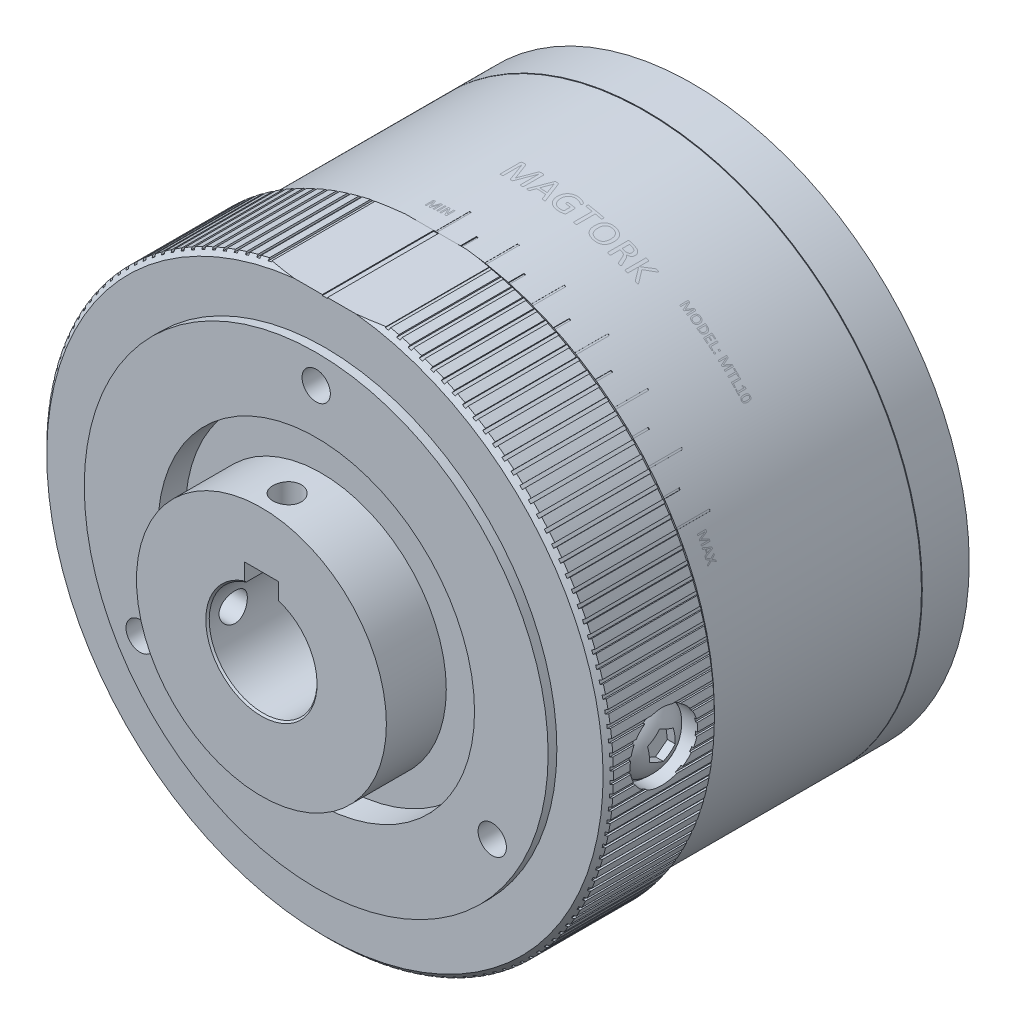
SolidWorks part; units mm, degrees
ref_plane "Front Plane" through (0, 0, 0) normal (0, 0, 1) x (1, 0, 0)
ref_plane "Top Plane" through (0, 0, 0) normal (0, 1, 0) x (1, 0, 0)
ref_plane "Right Plane" through (0, 0, 0) normal (1, 0, 0) x (0, 0, -1)
sketch "Sketch1" plane through (0, 0, 0) normal (1, 0, 0) x (0, 0, -1)
  line L0 (0, 0) -> (55.3488, 0) construction
  line L1 (0, 0) -> (0, 8.001) construction
  line L2 (0, 8.001) -> (0, 18.542)
  line L3 (0, 18.542) -> (8.89, 18.542)
  line L4 (8.128, 23.495) -> (8.128, 34.417)
  line L5 (8.128, 34.417) -> (9.4234, 34.417)
  line L6 (9.4234, 34.417) -> (9.4234, 42.037)
  line L7 (9.4234, 42.037) -> (25.9334, 42.037)
  line L8 (25.9334, 42.037) -> (25.9334, 41.021)
  line L9 (25.9334, 41.021) -> (56.9214, 41.021)
  line L10 (64.008, 41.021) -> (64.008, 8.001)
  line L11 (64.008, 8.001) -> (0, 8.001)
  line L12 (56.9214, 41.021) -> (56.9214, 40.894)
  line L13 (56.9214, 40.894) -> (57.0484, 40.894)
  line L14 (57.0484, 40.894) -> (57.0484, 41.021)
  line L15 (57.0484, 41.021) -> (64.008, 41.021)
  line L16 (8.89, 18.542) -> (8.89, 12.4968)
  line L17 (8.89, 12.4968) -> (12.192, 12.4968)
  line L18 (12.192, 12.4968) -> (12.192, 23.495)
  line L19 (12.192, 23.495) -> (8.128, 23.495)
  dimension "D1" = 16.002
  dimension "D2" = 37.084
  dimension "D3" = 84.074
  dimension "D4" = 82.042
  dimension "D5" = 64.008
  dimension "D6" = 55.88
  dimension "D7" = 54.5846
  dimension "D8" = 16.51
  dimension "D9" = 68.834
  dimension "D10" = 6.9596
  dimension "D11" = 0.127
  dimension "D12" = 0.127
  dimension "D13" = 24.9936
  dimension "D14" = 46.99
  dimension "D15" = 8.89
  dimension "D16" = 3.302
revolve "Revolve2" add sketch "Sketch1" angle 360 about L0
chamfer "Chamfer1" distance 0.762 angle 45 2 edges at (42.037, 0, -25.9334) (42.037, 0, -9.4234)
sketch "Sketch3" plane through (0, 0, -9.4234) normal (0, 0, 1) x (1, 0, 0)
  line L0 (0, 0) -> (0, -42.037) construction
  line L2 (-0.254, -42.291) -> (0.254, -42.291)
  line L3 (-0.254, -42.291) -> (-0.254, -41.783)
  line L4 (-0.254, -41.783) -> (0.254, -41.783)
  line L5 (0.254, -42.291) -> (0.254, -41.783)
  line L6 (-0.254, -42.291) -> (0.254, -41.783) construction
  line L7 (-0.254, -41.783) -> (0.254, -42.291) construction
  circle A0 centre (0, 0) radius 42.037 construction
  dimension "D1" = 0.508
  dimension "D2" = 0.508
extrude "Cut-Extrude2" cut sketch "Sketch3" against normal blind 72.136
pattern_circular "CirPattern1" count 150 over 360 about axis through (0, 0, 0) along (0, 0, 1) of "Cut-Extrude2"
sketch "Sketch2" plane through (0, 0, -9.4234) normal (0, 0, 1) x (1, 0, 0)
  line L0 (0, 0) -> (0, 41.021) construction
  line L1 (0, 41.021) -> (11.7059, 41.021)
  line L2 (0, 41.021) -> (-12.9169, 41.021)
  line L3 (-12.9169, 41.021) -> (-12.9169, 43.6558)
  line L4 (-12.9169, 43.6558) -> (11.7059, 43.6558)
  line L5 (11.7059, 43.6558) -> (11.7059, 41.021)
  dimension "D1" = 41.021
extrude "Cut-Extrude1" cut sketch "Sketch2" against normal up to next
sketch "Sketch4" plane through (0, 0, -9.4234) normal (0, 0, 1) x (1, 0, 0)
  line L0 (0, 41.021) -> (0, 40.894) construction
  line L1 (0, 40.894) -> (0.381, 40.894)
  line L2 (0, 40.894) -> (-0.381, 40.894)
  line L3 (-0.381, 40.894) -> (-0.381, 41.021)
  line L4 (-4.572, 41.021) -> (4.572, 41.021) construction
  line L5 (-0.381, 41.021) -> (0.381, 41.021)
  line L6 (0.381, 41.021) -> (0.381, 40.894)
  dimension "D1" = 0.127
  dimension "D2" = 0.762
extrude "Cut-Extrude3" cut sketch "Sketch4" against normal up to vertex
ref_plane "Plane1" through (42.037, 0, 0) normal (1, 0, 0) x (0, 0, -1)
sketch "Sketch5" plane through (42.037, 0, 0) normal (1, 0, 0) x (0, 0, -1)
  line L0 (9.4234, -0.127) -> (25.9334, -0.127) construction
  line L1 (9.4234, 41.021) -> (9.4234, -41.275) construction
  line L2 (25.9334, -41.275) -> (25.9334, 41.021) construction
  circle A0 centre (17.6784, -0.127) radius 5.0038
  dimension "D1" = 10.0076
extrude "Cut-Extrude4" cut sketch "Sketch5" against normal blind 2.54
sketch "Sketch6" plane through (0, 0, 0) normal (0, 1, 0) x (1, 0, 0)
  line L0 (39.4883, 17.6784) -> (42.0283, 17.6784) construction
  line L1 (39.4883, 10.1854) -> (39.4883, 25.1714) construction
  line L2 (39.4883, 17.6784) -> (39.4883, 22.3774) construction
  line L4 (39.4883, 17.6784) -> (42.0283, 17.6784)
  line L5 (39.4883, 17.6784) -> (39.4883, 22.3774)
  line L6 (39.4883, 22.3774) -> (39.4883, 17.6784)
  line L7 (39.4883, 22.3774) -> (39.9642, 22.3774)
  arc A0 (39.9642, 22.3774) -> (42.0283, 17.6784) centre (36.0555, 17.8576) cw
  dimension "D1" = 2.54
  dimension "D2" = 4.699
revolve "Revolve4" add sketch "Sketch6" angle 360 about L0
sketch "Sketch7" plane through (42.037, 0, 0) normal (1, 0, 0) x (0, 0, -1)
  line L1 (19.4446, 1.3461) -> (17.3957, 2.2027)
  line L2 (17.3957, 2.2027) -> (15.6295, 0.8565)
  line L3 (15.6295, 0.8565) -> (15.9122, -1.3461)
  line L4 (15.9122, -1.3461) -> (17.9611, -2.2027)
  line L5 (17.9611, -2.2027) -> (19.7273, -0.8565)
  line L6 (19.7273, -0.8565) -> (19.4446, 1.3461)
  circle A0 centre (17.6784, 0) radius 1.9232 construction
extrude "Cut-Extrude5" cut sketch "Sketch7" against normal blind 1.524
mirror "Mirror1" about plane through (0, 0, 0) normal (1, 0, 0) of "Cut-Extrude4", "Revolve4", "Cut-Extrude5"
sketch "Sketch8" plane through (0, 0, -64.008) normal (0, 0, -1) x (-1, 0, 0)
  circle A0 centre (0, 0) radius 23.495
  dimension "D1" = 46.99
extrude "Cut-Extrude6" cut sketch "Sketch8" against normal blind 4.064
ref_plane "Plane2" through (-18.542, 0, 0) normal (1, 0, 0) x (0, 0, -1)
hole_wizard "M5x0.8 Tapped Hole2" positions "Sketch17" profile "Sketch16" tap size "M5x0.8" standard "Ansi Metric"
sketch "Sketch17" plane through (0, 0, -8.128) normal (0, 0, 1) x (1, 0, 0)
  line L0 (0, 0) -> (-26.1215, -15.0813) construction
  line L2 (0, 0) -> (-21.1557, 0) construction
  point P0 (-26.1215, -15.0813)
  dimension "D1" = 30
  dimension "D2" = 30.1625
sketch "Sketch16" plane through (-26.1215, -15.0813, -8.128) normal (1, 0, 0) x (0, -1, 0)
  line L0 (0, 0) -> (0, 13.4538)
  line L1 (0, 13.4538) -> (2.1, 12.192)
  line L2 (2.1, 12.192) -> (2.1, 0)
  line L5 (2.1, 0) -> (0, 0)
  line L10 (0, 13.4538) -> (-2.1, 12.192) construction
  line L11 (0, -6.35) -> (0, 107.95) construction
  dimension "Tap Drill Dia." = 4.2
  dimension "Tap Drill Depth" = 12.192
  dimension "Drill Angle" = 118
pattern_circular "CirPattern3" count 3 over 360 about axis through (0, 0, 0) along (0, 0, 1) of "M5x0.8 Tapped Hole2"
ref_plane "Plane3" through (0, 0, -36.068) normal (0, 0, 1) x (1, 0, 0)
mirror "Mirror2" about plane through (0, 0, -36.068) normal (0, 0, 1) of "CirPattern3", "M5x0.8 Tapped Hole2"
sketch "Sketch18" plane through (0, 0, -64.008) normal (0, 0, -1) x (-1, 0, 0)
  line L0 (0, 0) -> (0, 38.354) construction
  circle A0 centre (0, 38.354) radius 2.1844
  dimension "D2" = 4.3688
  dimension "D1" = 38.354
extrude "Cut-Extrude10" cut sketch "Sketch18" against normal blind 2.54
sketch "Sketch19" plane through (0, 0, -61.468) normal (0, 0, -1) x (-1, 0, 0)
  circle A0 centre (0, 38.354) radius 1.778
  dimension "D1" = 3.556
extrude "Boss-Extrude2" add sketch "Sketch19" along normal blind 2.1844
sketch "Sketch20" plane through (0, 0, -63.6524) normal (0, 0, -1) x (-1, 0, 0)
  line L1 (1.1123, 38.8226) -> (0.1504, 39.5515)
  line L2 (0.1504, 39.5515) -> (-0.9619, 39.083)
  line L3 (-0.9619, 39.083) -> (-1.1123, 37.8854)
  line L4 (-1.1123, 37.8854) -> (-0.1504, 37.1565)
  line L5 (-0.1504, 37.1565) -> (0.9619, 37.625)
  line L6 (0.9619, 37.625) -> (1.1123, 38.8226)
  circle A0 centre (0, 38.354) radius 1.0452 construction
extrude "Cut-Extrude11" cut sketch "Sketch20" against normal blind 1.524
pattern_circular "CirPattern4" count 4 over 360 about axis through (0, 0, 0) along (0, 0, 1) of "Cut-Extrude11", "Boss-Extrude2", "Cut-Extrude10"
chamfer "Chamfer3" distance 0.254 angle 45 2 edges at (-8.001, 0, -59.944) (8.001, 0, 0)
ref_plane "Plane4" through (0, 41.021, 0) normal (0, 1, 0) x (-1, 0, 0)
ref_plane "Plane5" through (0, 0, -25.9334) normal (0, 0, 1) x (1, 0, 0)
sketch "Sketch21" plane through (0, 0, -25.9334) normal (0, 0, 1) x (1, 0, 0)
  line L0 (0, 0) -> (0, 41.021) construction
  line L1 (0.127, 40.9956) -> (0.127, 41.021)
  line L2 (-0.127, 40.9956) -> (-0.127, 41.021)
  line L3 (-0.127, 41.021) -> (0.127, 41.021)
  line L4 (-0.127, 40.9956) -> (0.127, 40.9956)
  line L5 (-0.127, 0) -> (-0.127, 41.021) construction
  line L6 (0.127, 0) -> (0.127, 41.021) construction
  arc A0 (0.381, 41.0192) -> (-0.381, 41.0192) centre (0, 0) ccw construction
  dimension "D3" = 0.0254
  dimension "D1" = 0.127
  dimension "D2" = 0.127
extrude "Cut-Extrude12" cut sketch "Sketch21" against normal blind 5.08
pattern_circular "CirPattern5" count 7 over 60 about axis through (0, 0, 0) along (0, 0, 1) of "Cut-Extrude12"
sketch "Sketch25" plane through (0, 0, -25.9334) normal (0, 0, 1) x (1, 0, 0)
  line L0 (0, 0) -> (3.5752, 40.8649) construction
  line L1 (0, 0) -> (0, 18.1035) construction
  line L2 (3.6907, 40.7273) -> (3.7017, 40.8538)
  line L3 (-0.1265, 0.0111) -> (0, 1.4572)
  line L4 (3.4376, 40.7495) -> (3.6907, 40.7273)
  line L5 (3.4376, 40.7495) -> (3.4487, 40.876)
  line L6 (-0.1265, 0.0111) -> (3.4487, 40.876) construction
  line L7 (0.1265, -0.0111) -> (3.7017, 40.8538) construction
  circle A0 centre (0, 0) radius 41.021 construction
  arc A1 (3.7017, 40.8536) -> (3.4487, 40.8758) centre (0, 0) ccw
  dimension "D4" = 40.894
  dimension "D1" = 5
  dimension "D2" = 0.127
  dimension "D3" = 0.127
extrude "Cut-Extrude14" cut sketch "Sketch25" against normal blind 2.54 contours L2 A1 L5 L4
pattern_circular "CirPattern6" count 6 over 50 about axis through (0, 0, 0) along (0, 0, 1) of "Cut-Extrude14"
sketch "Sketch31" plane through (0, 41.021, 0) normal (0, 1, 0) x (-1, 0, 0)
  line L0 (3.2001, -38.144) -> (-26.7016, -38.144) construction
  text T0 "MAGTORK"
wrap "Wrap3" sketch "Sketch31" wrap type scribe source sketch "Sketch31"
sketch "Sketch32" plane through (0, 41.021, 0) normal (0, 1, 0) x (-1, 0, 0)
  line L0 (-22.396, -40.6101) -> (-35.9719, -40.6101) construction
  text T0 "MODEL: MTL10" font "Calibri" height 1.27
wrap "Wrap4" sketch "Sketch32" wrap type scribe source sketch "Sketch32"
sketch "Sketch33" plane through (0, 41.021, 0) normal (0, 1, 0) x (-1, 0, 0)
  line L0 (1.1577, -28.7736) -> (11.0649, -28.7736) construction
  text T0 "MIN" font "Calibri" height 1.27
wrap "Wrap5" sketch "Sketch33" wrap type scribe source sketch "Sketch33"
sketch "Sketch34" plane through (0, 41.021, 0) normal (0, 1, 0) x (-1, 0, 0)
  line L0 (-44.406, -28.3685) -> (-49.835, -28.3685) construction
  text T0 "MAX" font "Calibri" height 1.27
wrap "Wrap6" sketch "Sketch34" wrap type scribe source sketch "Sketch34"
sketch "Sketch38" plane through (0, 0, 0) normal (0, 0, 1) x (1, 0, 0)
  line L0 (0, -8.001) -> (0, 10.3124) construction
  line L1 (0, 10.3124) -> (2.5019, 10.3124)
  line L2 (0, 10.3124) -> (-2.5019, 10.3124)
  line L3 (-2.5019, 10.3124) -> (-2.5019, 6.5024)
  line L4 (-2.5019, 6.5024) -> (2.5019, 6.5024)
  line L5 (2.5019, 6.5024) -> (2.5019, 10.3124)
  circle A1 centre (0, 0) radius 8.001 construction
  dimension "D1" = 18.3134
  dimension "D2" = 5.0038
  dimension "D3" = 3.81
extrude "Cut-Extrude15" cut sketch "Sketch38" against normal through all
hole_wizard "M5x0.8 Tapped Hole3" positions "Sketch40" profile "Sketch39" tap size "M5x0.8" standard "ANSI Metric"
sketch "Sketch40" plane through (-18.542, 0, 0) normal (1, 0, 0) x (0, 0, -1)
  line L0 (3.81, 0) -> (0, 0) construction
  line L1 (0, 18.542) -> (0, -18.542) construction
  point P0 (3.81, 0)
  dimension "D1" = 3.81
sketch "Sketch39" plane through (-18.542, 0, -3.81) normal (0, 1, 0) x (0, 0, 1)
  line L0 (0, 0) -> (0, 37.084)
  line L1 (0, 37.084) -> (2.1, 37.084)
  line L2 (2.1, 37.084) -> (2.1, 0)
  line L5 (2.1, 0) -> (0, 0)
  line L11 (0, -6.35) -> (0, 107.95) construction
  dimension "Thru Tap Drill Dia." = 4.2
  dimension "Thru Tap Drill Depth" = 37.084
pattern_circular "CirPattern7" count 2 over 90 about axis through (0, 0, 0) along (0, 0, 1) of "M5x0.8 Tapped Hole3"
